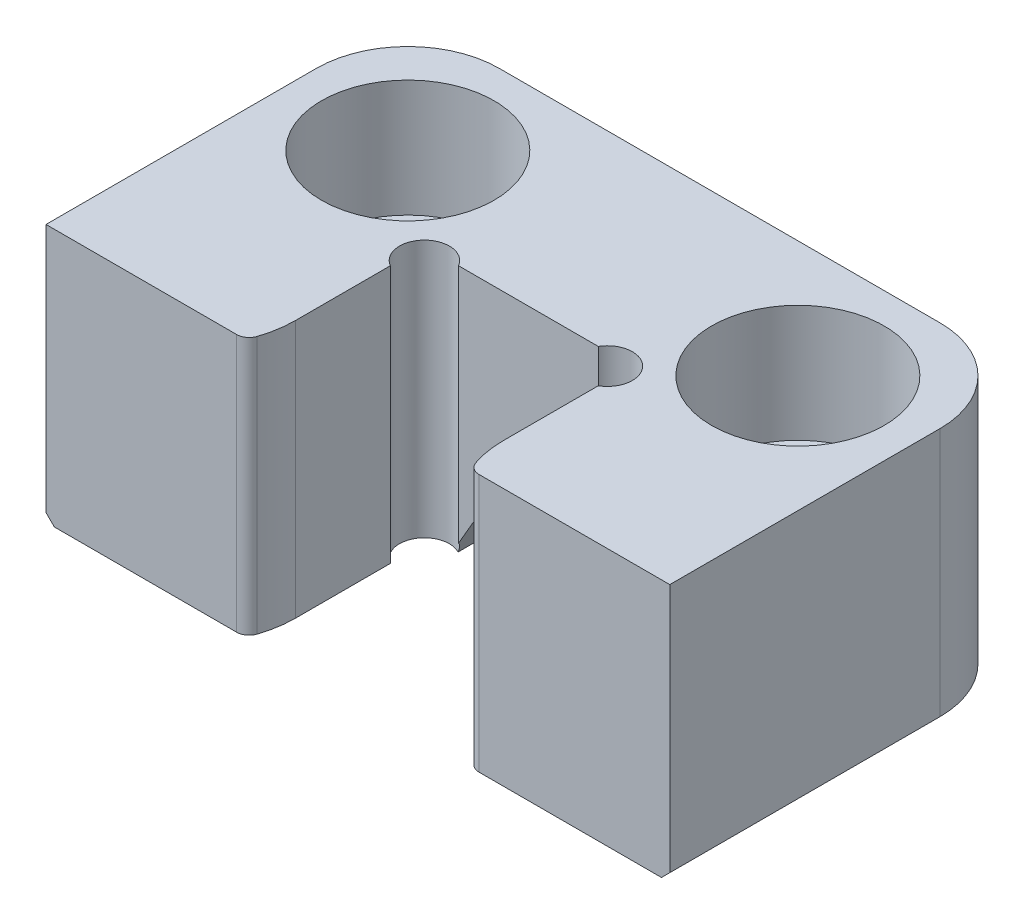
SolidWorks part; units mm, degrees
ref_plane "Front Plane" through (0, 0, 0) normal (0, 0, 1) x (1, 0, 0)
ref_plane "Top Plane" through (0, 0, 0) normal (0, 1, 0) x (1, 0, 0)
ref_plane "Right Plane" through (0, 0, 0) normal (1, 0, 0) x (0, 0, -1)
sketch "Sketch1" plane through (0, 0, 0) normal (0, 1, 0) x (1, 0, 0)
  line L0 (0, 0) -> (0, 50000) construction
  line L1 (0, 0) -> (50000, 0) construction
  line L2 (6.35, 0) -> (19.05, 0)
  line L3 (-19.05, 0) -> (-6.35, 0)
  line L4 (-19.05, 0) -> (-19.05, 22.098)
  line L5 (-19.05, 22.098) -> (19.05, 22.098)
  line L6 (19.05, 0) -> (19.05, 22.098)
  line L8 (-6.35, 0) -> (-6.35, 10.414)
  line L9 (-6.35, 10.414) -> (6.35, 10.414)
  line L10 (6.35, 0) -> (6.35, 10.414)
  dimension "D1" = 22.098
  dimension "D2" = 38.1
  dimension "D3" = 12.7
  dimension "D4" = 10.414
extrude "Boss-Extrude1" add sketch "Sketch1" against normal blind 15.748 separate body
fillet "Fillet1" radius 5.588 2 edges at (19.05, -7.874, -22.098) (-19.05, -7.874, -22.098)
sketch "Sketch2" plane through (0, 0, 0) normal (0, 1, 0) x (1, 0, 0)
  line L0 (0, 0) -> (0, 50000) construction
  line L1 (-6.35, 0) -> (-6.35, 10.414) construction
  line L2 (-19.05, 0) -> (-6.35, 0) construction
  line L3 (-6.35, 2.54) -> (-6.35, 3.4579)
  line L4 (-28.575, 0) -> (-6.8801, 0)
  line L5 (28.575, 0) -> (28.575, -12.7)
  line L6 (-28.575, -12.7) -> (28.575, -12.7)
  line L7 (-6.35, 3.4579) -> (6.35, 3.4579)
  line L8 (-28.575, 0) -> (-28.575, -12.7)
  line L9 (28.575, 0) -> (6.8801, 0)
  line L10 (6.35, 2.54) -> (6.35, 3.4579)
  arc A4 (6.8801, 0) -> (6.35, 2.54) centre (12.7, 2.54) cw
  arc A5 (-6.8801, 0) -> (-6.35, 2.54) centre (-12.7, 2.54) ccw
  point P14 (0, -12.7)
  point P24 (0, 3.4579)
  dimension "D1" = 2.54
  dimension "D5" = 12.7
extrude "Cut-Extrude1" cut sketch "Sketch2" against normal through all
sketch "Sketch3" plane through (0, 0, 0) normal (0, 1, 0) x (1, 0, 0)
  line L1 (-6.35, 10.414) -> (6.35, 10.414) construction
  line L2 (-7.112, 2.54) -> (-7.112, 10.414)
  line L3 (-7.112, 2.54) -> (-7.112, 10.414) construction
  line L4 (0, 0) -> (0, 50000) construction
  line L6 (-6.35, 11.176) -> (6.35, 11.176) construction
  circle A0 centre (-5.588, 9.652) radius 1.524
  circle A1 centre (5.588, 9.652) radius 1.524
  dimension "D3" = 1.524
  dimension "D2" = 0.762
  dimension "D1" = 0.762
extrude "Cut-Extrude2" cut sketch "Sketch3" against normal through all
sketch "Sketch5" plane through (0, 0, -22.098) normal (0, 0, -1) x (-1, 0, 0)
  line L0 (-3.9688, -14.1605) -> (3.9688, -14.1605)
  line L1 (-13.462, 0) -> (13.462, 0) construction
  line L2 (0, 0) -> (0, 50000) construction
  line L3 (3.9688, -14.1605) -> (4.8853, -15.748)
  line L4 (-13.462, -15.748) -> (13.462, -15.748) construction
  line L5 (-4.8853, -15.748) -> (4.8853, -15.748)
  line L6 (-3.9688, -14.1605) -> (-4.8853, -15.748)
  point P4 (0, 0)
  point P12 (0, -15.748)
  point P13 (0, -14.1605)
  dimension "D1" = 30
  dimension "D2" = 1.5875
  dimension "D3" = 7.9375
extrude "Cut-Extrude3" cut sketch "Sketch5" against normal through all
chamfer "Chamfer1" distance 0.508 angle 45 6 edges at (9.1736, -15.748, -22.098) (17.4133, -15.748, -20.4613) (19.05, -15.748, -8.255) (-9.1736, -15.748, -22.098) (-17.4133, -15.748, -20.4613) (-19.05, -15.748, -8.255)
chamfer "Chamfer5" distance 3.81 angle 15 1 edges at (0, -14.1605, -10.414)
hole_wizard "1/4\" CBORE" positions "Sketch7" profile "Sketch6" counterbore size "1/4" standard "Ansi Inch"
sketch "Sketch7" plane through (9.0831, 0, -5.226) normal (0, 1, 0) x (-1, 0, 0)
  line L0 (9.0831, 0) -> (9.0831, 50000) construction
  line L1 (-4.3789, -16.872) -> (22.5451, -16.872) construction
  line L2 (28.1331, -11.284) -> (28.1331, 5.226) construction
  point P0 (20.9957, -9.7346)
  point P11 (-2.8295, -9.7346)
  dimension "D1" = 7.1374
  dimension "D2" = 7.1374
sketch "Sketch6" plane through (-11.9126, 0, -14.9606) normal (1, 0, 0) x (0, 0, 1)
  line L0 (0, 0) -> (0, 15.748)
  line L1 (0, 15.748) -> (3.2639, 15.748)
  line L3 (3.2639, 15.748) -> (3.2639, 7.1437)
  line L4 (3.2639, 7.1437) -> (5.2705, 7.1437)
  line L5 (5.2705, 7.1437) -> (5.2705, 0)
  line L7 (5.2705, 0) -> (0, 0)
  line L11 (0, -6.35) -> (0, 107.95) construction
  dimension "Thru Hole Dia." = 6.5278
  dimension "Thru Hole Depth" = 15.748
  dimension "C'Bore Dia." = 10.541
  dimension "C'Bore Depth" = 7.1437
fillet "Fillet2" radius 0.762 2 edges at (6.8801, -7.874, 0) (-6.8801, -7.874, 0)
